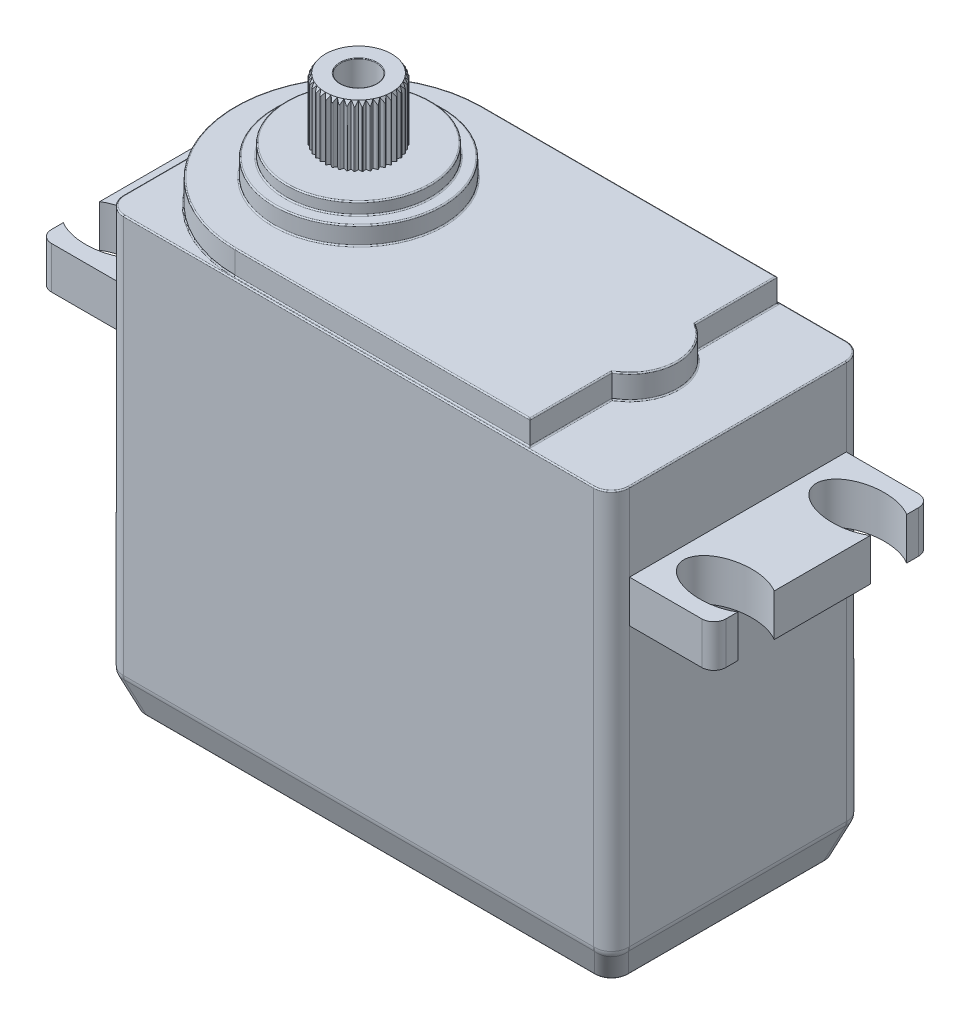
SolidWorks part; units mm, degrees
ref_plane "前视" through (0, 0, 0) normal (0, 0, 1) x (1, 0, 0)
ref_plane "上视" through (0, 0, 0) normal (0, 1, 0) x (1, 0, 0)
ref_plane "右视" through (0, 0, 0) normal (1, 0, 0) x (0, 0, -1)
sketch "草图1" plane through (0, 0, 0) normal (0, 1, 0) x (1, 0, 0)
  line L1 (0, 0) -> (42, 0)
  line L2 (0, 0) -> (0, -21)
  line L3 (0, -21) -> (42, -21)
  line L4 (42, 0) -> (42, -21)
  dimension "D1" = 42
  dimension "D2" = 21
extrude "凸台-拉伸1" add sketch "草图1" along normal blind 26
sketch "草图2" plane through (0, 26, 0) normal (0, 1, 0) x (1, 0, 0)
  line L0 (-7, -1.5) -> (-7, -3.4913)
  line L1 (21, 0) -> (21, -21) construction
  line L2 (42, 0) -> (0, 0) construction
  line L3 (0, -21) -> (42, -21) construction
  line L4 (42, -21) -> (42, 0) construction
  line L5 (42, -1.5) -> (49, -1.5)
  line L6 (42, -1.5) -> (42, -19.5)
  line L7 (42, -19.5) -> (49, -19.5)
  line L8 (49, -1.5) -> (49, -3.4913)
  line L9 (0, -19.5) -> (-7, -19.5)
  line L10 (0, -1.5) -> (0, -19.5)
  line L11 (0, -1.5) -> (-7, -1.5)
  line L12 (-7, -6.5087) -> (-7, -14.4913)
  line L13 (-7, -17.5087) -> (-7, -19.5)
  line L14 (49, -6.5087) -> (49, -14.4913)
  line L15 (49, -17.5087) -> (49, -19.5)
  ellipse E0 centre (46.5, -5) end of major axis (50, -5) minor radius 2.1557 (49, -3.4913) -> (49, -6.5087) ccw
  ellipse E1 centre (46.5, -16) end of major axis (50, -16) minor radius 2.1557 (49, -17.5087) -> (49, -14.4913) cw
  ellipse E2 centre (-4.5, -16) end of major axis (-8, -16) minor radius 2.1557 (-7, -17.5087) -> (-7, -14.4913) ccw
  ellipse E3 centre (-4.5, -5) end of major axis (-8, -5) minor radius 2.1557 (-7, -3.4913) -> (-7, -6.5087) cw
  dimension "D4" = 2.5
  dimension "D1" = 7
  dimension "D2" = 18
  dimension "D3" = 1.5
  dimension "D5" = 3.5
  dimension "D6" = 3.5
extrude "凸台-拉伸2" add sketch "草图2" along normal blind 3.5 separate body
sketch "草图3" plane through (0, 26, 0) normal (0, 1, 0) x (1, 0, 0)
  line L1 (0, 0) -> (42, 0)
  line L2 (0, 0) -> (0, -21)
  line L3 (0, -21) -> (42, -21)
  line L4 (42, 0) -> (42, -21)
extrude "凸台-拉伸3" add sketch "草图3" along normal blind 10
sketch "草图4" plane through (0, 36, 0) normal (0, 1, 0) x (1, 0, 0)
  line L0 (0, -19.5) -> (0, -1.5) construction
  line L1 (10.5, -20.75) -> (35, -20.75)
  line L2 (35, -20.75) -> (35, -13.9641)
  line L3 (35, -0.25) -> (10.5, -0.25)
  line L4 (35, -7.0359) -> (35, -0.25)
  arc A0 (10.5, -0.25) -> (10.5, -20.75) centre (10.5, -10.5) ccw
  arc A1 (35, -13.9641) -> (35, -7.0359) centre (33, -10.5) ccw
  dimension "D1" = 20.5
  dimension "D4" = 8
  dimension "D2" = 10.5
  dimension "D3" = 35
  dimension "D5" = 2
extrude "凸台-拉伸4" add sketch "草图4" along normal blind 2
sketch "草图5" plane through (0, 38, 0) normal (0, 1, 0) x (1, 0, 0)
  circle A0 centre (10.5, -10.5) radius 7
  dimension "D1" = 14
extrude "凸台-拉伸5" add sketch "草图5" along normal blind 1.5
sketch "草图6" plane through (0, 39.5, 0) normal (0, 1, 0) x (1, 0, 0)
  circle A0 centre (10.5, -10.5) radius 6
  dimension "D1" = 12
extrude "凸台-拉伸6" add sketch "草图6" along normal blind 1
sketch "草图7" plane through (0, 40.5, 0) normal (0, 1, 0) x (1, 0, 0)
  circle A0 centre (10.5, -10.5) radius 3
  circle A1 centre (10.5, -10.5) radius 1.5
  dimension "D1" = 6
  dimension "D2" = 3
extrude "凸台-拉伸7" add sketch "草图7" along normal blind 5
chamfer "倒角1" distance 1 angle 70 4 edges at (21, 0, 21) (42, 0, 10.5) (21, 0, 0) (0, 0, 10.5)
fillet "圆角1" radius 1.5 8 edges at (42, 19.3737, 0) (41.5, 1.3737, 0.5) (42, 19.3737, 21) (41.5, 1.3737, 20.5) (0.5, 1.3737, 0.5) (0, 19.3737, 0) (0.5, 1.3737, 20.5) (0, 19.3737, 21)
fillet "圆角2" radius 1 4 edges at (-7, 27.75, 1.5) (-7, 27.75, 19.5) (49, 27.75, 19.5) (49, 27.75, 1.5)
fillet "圆角5" radius 1 16 edges at (1.456, 2.7457, 20.9994) (0.0006, 2.7457, 19.544) (0, 2.7475, 10.5) (0.0006, 2.7457, 1.456) (0.4393, 2.6486, 0.4393) (1.456, 2.7457, 0.0006) (21, 2.7475, 0) (40.544, 2.7457, 0.0006) (41.5607, 2.6486, 0.4393) (41.9994, 2.7457, 1.456) (42, 2.7475, 10.5) (41.9994, 2.7457, 19.544) (41.5607, 2.6486, 20.5607) (40.544, 2.7457, 20.9994) (0.4393, 2.6486, 20.5607) (21, 2.7475, 21)
fillet "圆角6" radius 0.1 8 edges at (1.4033, 0, 1.4033) (1, 0, 10.5) (1.4033, 0, 19.5967) (21, 0, 20) (40.5967, 0, 19.5967) (41, 0, 10.5) (40.5967, 0, 1.4033) (21, 0, 1)
fillet "圆角10" radius 0.1 24 edges at (10.5, 40.5, 16.5) (10.5, 39.5, 16.5) (10.5, 39.5, 17.5) (10.5, 38, 17.5) (35, 38, 17.3571) (22.75, 38, 20.75) (0.25, 38, 10.5) (22.75, 38, 0.25) (35, 38, 3.6429) (37, 38, 10.5) (22.75, 36, 0.25) (0.25, 36, 10.5) (22.75, 36, 20.75) (35, 36, 17.3571) (37, 36, 10.5) (35, 36, 3.6429) (41.5607, 36, 20.5607) (21, 36, 21) (0.4393, 36, 20.5607) (0, 36, 10.5) (0.4393, 36, 0.4393) (21, 36, 0) (41.5607, 36, 0.4393) (42, 36, 10.5)
chamfer "倒角2" distance 0.4 angle 32 1 edges at (10.5, 45.5, 13.5)
sketch "草图8" plane through (0, 45.5, 0) normal (0, 1, 0) x (1, 0, 0)
  line L1 (10.2, -7.45) -> (10.5, -7.75)
  line L2 (10.5, -7.75) -> (10.8, -7.45)
  arc A2 (10.8, -7.45) -> (10.2, -7.45) centre (10.5, -10.5) ccw
  circle A3 centre (10.5, -10.5) radius 1.5 construction
  dimension "D1" = 0.3
  dimension "D2" = 2.75
  dimension "D3" = 0.3
  dimension "D4" = 0.3
extrude "切除-拉伸1" cut sketch "草图8" against normal blind 5
pattern_circular "阵列(圆周)1" count 40 over 360 about axis through (10.5, 0, 10.5) along (0, 1, 0) of "切除-拉伸1"
fillet "圆角11" radius 0.05 40 edges at (13.0529, 42.8047, 12.0644) (12.7768, 42.8047, 12.4445) (12.4445, 42.8047, 12.7768) (12.0644, 42.8047, 13.0529) (11.6458, 42.8047, 13.2662) (11.199, 42.8047, 13.4114) (10.7349, 42.8047, 13.4849) (10.2651, 42.8047, 13.4849) (9.801, 42.8047, 13.4114) (9.3542, 42.8047, 13.2662) (8.9356, 42.8047, 13.0529) (8.5555, 42.8047, 12.7768) (8.2232, 42.8047, 12.4445) (7.9471, 42.8047, 12.0644) (7.7338, 42.8047, 11.6458) (7.5886, 42.8047, 11.199) (7.5151, 42.8047, 10.7349) (7.5151, 42.8047, 10.2651) (7.5886, 42.8047, 9.801) (7.7338, 42.8047, 9.3542) (7.9471, 42.8047, 8.9356) (8.2232, 42.8047, 8.5555) (8.5555, 42.8047, 8.2232) (8.9356, 42.8047, 7.9471) (9.3542, 42.8047, 7.7338) (9.801, 42.8047, 7.5886) (10.2651, 42.8047, 7.5151) (10.7349, 42.8047, 7.5151) (11.199, 42.8047, 7.5886) (12.0644, 42.8047, 7.9471) (11.6458, 42.8047, 7.7338) (12.4445, 42.8047, 8.2232) (12.7768, 42.8047, 8.5555) (13.0529, 42.8047, 8.9356) (13.2662, 42.8047, 9.3542) (13.4114, 42.8047, 9.801) (13.4849, 42.8047, 10.2651) (13.4849, 42.8047, 10.7349) (13.4114, 42.8047, 11.199) (13.2662, 42.8047, 11.6458)
fillet "圆角12" radius 0.05 1 edges at (10.5, 45.5, 12)
